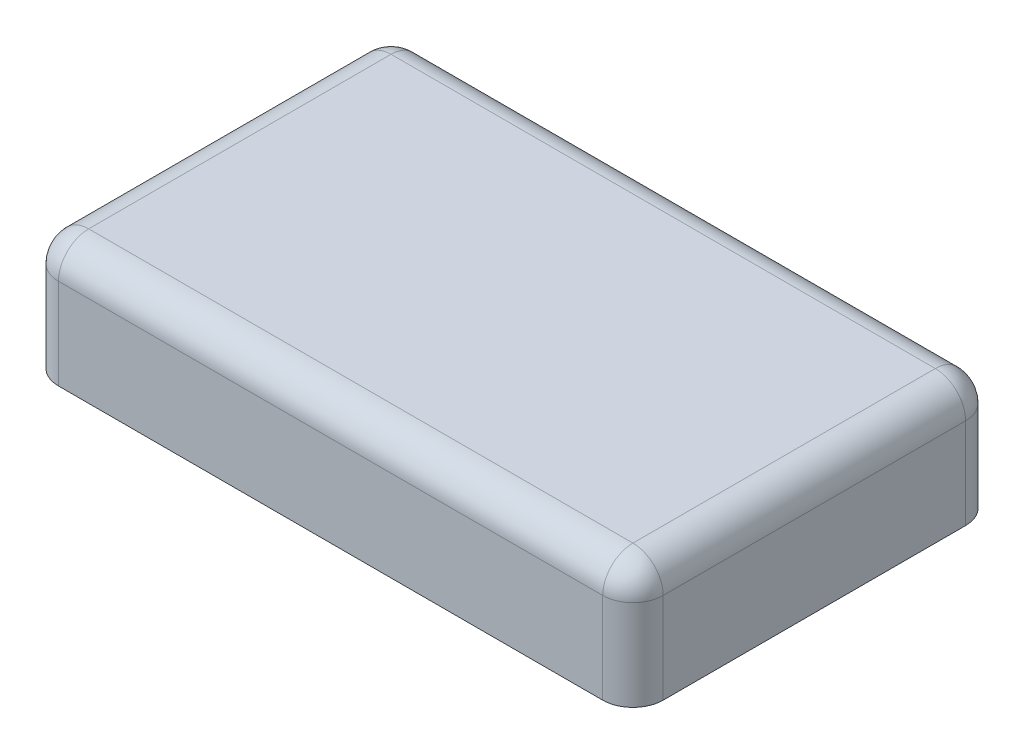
SolidWorks part; units mm, degrees
ref_plane "Front" through (0, 0, 0) normal (0, 0, 1) x (1, 0, 0)
ref_plane "Top" through (0, 0, 0) normal (0, 1, 0) x (1, 0, 0)
ref_plane "Right" through (0, 0, 0) normal (1, 0, 0) x (0, 0, -1)
sketch "Sketch2" plane through (0, 0, 0) normal (0, 1, 0) x (1, 0, 0)
  line L1 (-63.5, -38.1) -> (63.5, -38.1)
  line L2 (-63.5, -38.1) -> (-63.5, 38.1)
  line L3 (-63.5, 38.1) -> (63.5, 38.1)
  line L4 (63.5, -38.1) -> (63.5, 38.1)
  line L5 (-63.5, -38.1) -> (63.5, 38.1) construction
  line L6 (-63.5, 38.1) -> (63.5, -38.1) construction
  point P0 (0, 0)
  dimension "D1" = 127
  dimension "D2" = 76.2
extrude "Boss-Extrude1" add sketch "Sketch2" along normal blind 25.4
fillet "Fillet1" radius 6.35 4 edges at (63.5, 12.7, 38.1) (-63.5, 12.7, -38.1) (63.5, 12.7, -38.1) (-63.5, 12.7, 38.1)
fillet "Fillet2" radius 6.35 8 edges at (-61.6401, 25.4, 36.2401) (-63.5, 25.4, 0) (-61.6401, 25.4, -36.2401) (0, 25.4, -38.1) (61.6401, 25.4, -36.2401) (63.5, 25.4, 0) (61.6401, 25.4, 36.2401) (0, 25.4, 38.1)
